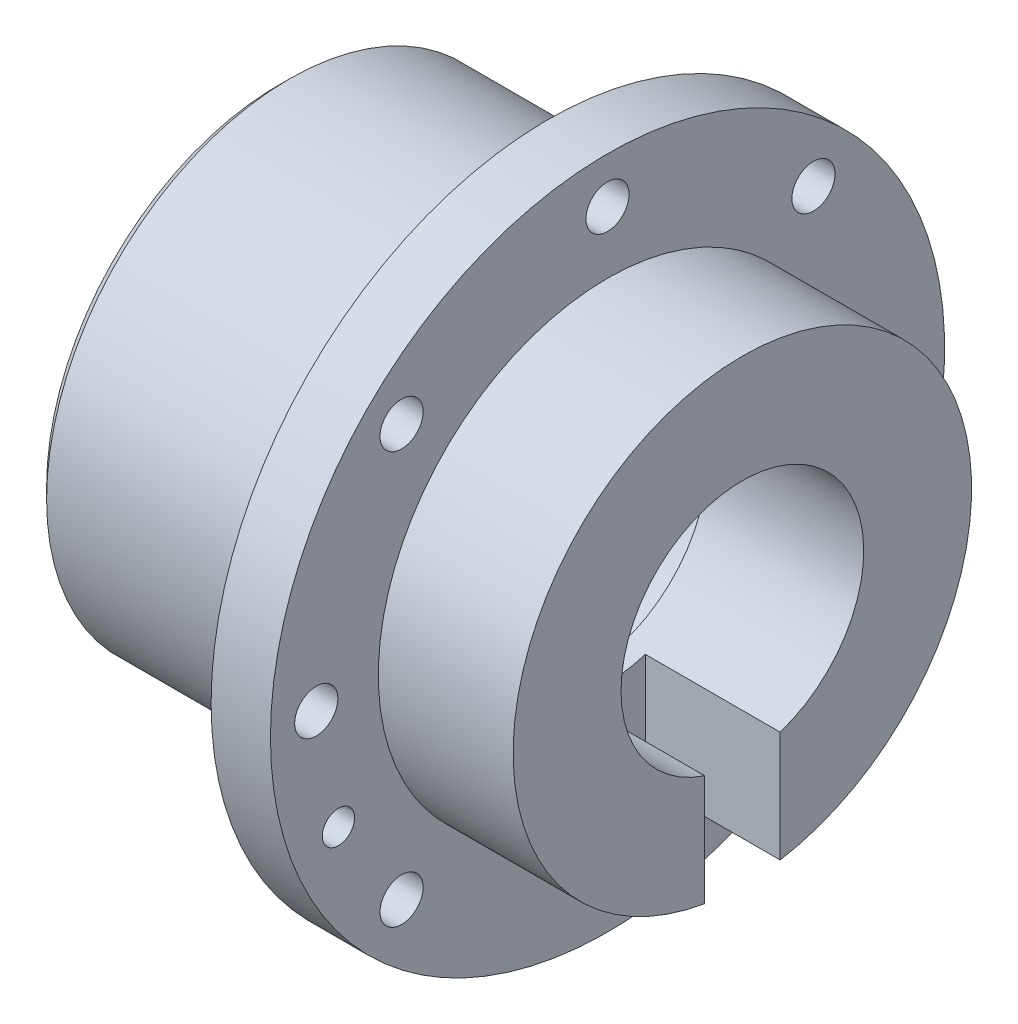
SolidWorks part; units mm, degrees
ref_plane "Face" through (0, 0, 0) normal (0, 0, 1) x (1, 0, 0)
ref_plane "Dessus" through (0, 0, 0) normal (0, 1, 0) x (1, 0, 0)
ref_plane "Droite" through (0, 0, 0) normal (1, 0, 0) x (0, 0, -1)
sketch "Esquisse1" plane through (0, 0, 0) normal (0, 0, 1) x (1, 0, 0)
  line L0 (0, 0) -> (79.0367, 0) construction
  line L1 (0.2953, 45) -> (48.2953, 45)
  line L2 (48.2953, 45) -> (48.2953, 62.5)
  line L3 (48.2953, 62.5) -> (59.2953, 62.5)
  line L4 (59.2953, 62.5) -> (59.2953, 42.5)
  line L5 (59.2953, 42.5) -> (84.2953, 42.5)
  line L6 (84.2953, 42.5) -> (84.2953, 22.5)
  line L7 (84.2953, 22.5) -> (55.3049, 22.5)
  line L8 (55.3049, 22.5) -> (52.4181, 27.5)
  line L9 (52.4181, 27.5) -> (26.2953, 27.5)
  line L10 (26.2953, 27.5) -> (26.2953, 32.5)
  line L11 (26.2953, 32.5) -> (5.7953, 32.5)
  line L12 (-1.7047, 40) -> (-1.7047, 43)
  line L13 (55.3049, 22.5) -> (68.2953, 0) construction
  line L14 (5.7953, 32.5) -> (-1.7047, 40)
  line L15 (-1.7047, 43) -> (0.2953, 45)
  point P3 (-1.7047, 45)
  point P15 (-1.7047, 32.5)
  dimension "D1" = 45
  dimension "D2" = 55
  dimension "D3" = 65
  dimension "D4" = 90
  dimension "D5" = 125
  dimension "D6" = 85
  dimension "D7" = 28
  dimension "D8" = 86
  dimension "D9" = 25
  dimension "D10" = 50
  dimension "D11" = 60
  dimension "D12" = 70
  dimension "D13" = 7.5
  dimension "D14" = 45
  dimension "D15" = 2
  dimension "D16" = 45
revolve "Révolution1" add sketch "Esquisse1" angle 360 about L0
sketch "Esquisse2" plane through (84.2953, 0, 0) normal (1, 0, 0) x (0, 0, -1)
  line L0 (0, 0) -> (0, -71.2403) construction
  line L2 (-7, -13.1017) -> (7, -13.1017)
  line L3 (-7, -13.1017) -> (-7, -54.6585)
  line L4 (-7, -54.6585) -> (7, -54.6585)
  line L5 (7, -13.1017) -> (7, -54.6585)
  dimension "D1" = 14
  dimension "D2" = 7
extrude "Enlèv. mat.-Extru.1" cut sketch "Esquisse2" against normal blind 25
sketch "Esquisse3" plane through (59.2953, 0, 0) normal (1, 0, 0) x (0, 0, -1)
  line L0 (0, 0) -> (0, 80.2477) construction
hole_wizard "Trou taraudé M101" positions "Esquisse8" profile "Esquisse7" tap size "M10" standard "ISO"
sketch "Esquisse8" plane through (59.2953, 0, 0) normal (1, 0, 0) x (0, 0, -1)
  line L0 (0, 0) -> (0, 80.2477) construction
  circle A0 centre (0, 0) radius 62.5 construction
  point P0 (0, 54)
  dimension "D1" = 54
sketch "Esquisse7" plane through (59.2953, 54, 0) normal (0, 1, 0) x (0, 0, -1)
  line L0 (0, 0) -> (0, 61)
  line L1 (0, 61) -> (4, 61)
  line L2 (4, 61) -> (4, 0)
  line L5 (4, 0) -> (0, 0)
  line L11 (0, -6.35) -> (0, 107.95) construction
  dimension "Diamètre du trou pour taraudage jusqu'au prochain" = 8
  dimension "Profondeur du trou pour taraudage jusqu'au prochain" = 61
pattern_circular "Répétition circulaire1" count 8 every 45 about axis through (0, 0, 0) along (1, 0, 0) of "Trou taraudé M101"
sketch "Esquisse9" plane through (59.2953, 0, 0) normal (1, 0, 0) x (0, 0, -1)
  line L0 (0, 0) -> (-75.054, -31.0884) construction
  line L1 (0, 0) -> (-104.3273, 0) construction
  dimension "D1" = 22.5
hole_wizard "Trou taraudé M81" positions "Esquisse11" profile "Esquisse10" tap size "M8" standard "ISO"
sketch "Esquisse11" plane through (59.2953, 0, 0) normal (1, 0, 0) x (0, 0, -1)
  line L0 (0, 0) -> (-75.054, -31.0884) construction
  circle A0 centre (0, 0) radius 62.5 construction
  point P0 (-49.8895, -20.6649)
  dimension "D1" = 54
sketch "Esquisse10" plane through (59.2953, -20.6649, 49.8895) normal (0, 1, 0) x (0, 0, -1)
  line L0 (0, 0) -> (0, 61)
  line L1 (0, 61) -> (3, 61)
  line L2 (3, 61) -> (3, 0)
  line L5 (3, 0) -> (0, 0)
  line L11 (0, -6.35) -> (0, 107.95) construction
  dimension "Diamètre du trou pour taraudage jusqu'au prochain" = 6
  dimension "Profondeur du trou pour taraudage jusqu'au prochain" = 61
pattern_circular "Répétition circulaire2" count 2 every 135 about axis through (0, 0, 0) along (1, 0, 0) of "Trou taraudé M81"
